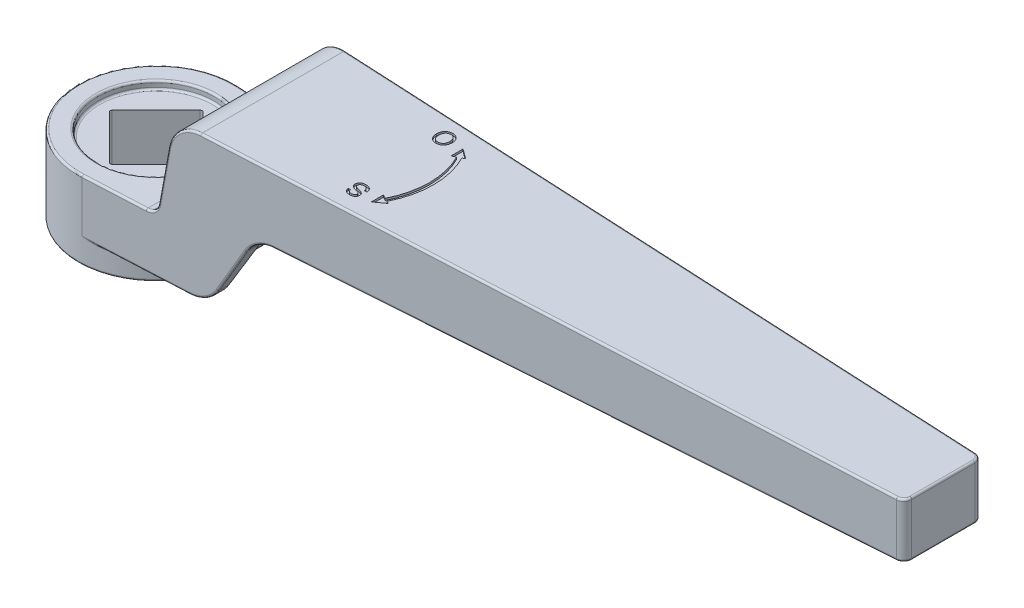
SolidWorks part; units mm, degrees
ref_plane "前基準面" through (0, 0, 0) normal (0, 0, 1) x (1, 0, 0)
ref_plane "上基準面" through (0, 0, 0) normal (0, 1, 0) x (1, 0, 0)
ref_plane "右基準面" through (0, 0, 0) normal (1, 0, 0) x (0, 0, -1)
sketch "草圖1" plane through (0, 0, 0) normal (0, 0, 1) x (1, 0, 0)
  line L1 (-42, 14) -> (-42, -6)
  line L2 (-42, -6) -> (0, -6)
  line L3 (0, 0) -> (0, -6)
  line L4 (-42, 14) -> (-3.2856, 14)
  line L5 (-0.3312, 16.4791) -> (2.1215, 30.3892)
  line L6 (0, 0) -> (7.25, 0)
  line L7 (10, 37) -> (182, 37)
  line L8 (14.1782, 4) -> (21.1073, 16.0015)
  line L9 (27.8798, 20) -> (182, 23)
  line L10 (182, 37) -> (182, 23)
  arc A11 (-3.2856, 14) -> (-0.3312, 16.4791) centre (-3.2856, 17) ccw
  arc A12 (7.25, 0) -> (14.1782, 4) centre (7.25, 8) ccw
  arc A13 (27.8798, 20) -> (21.1073, 16.0015) centre (28.0355, 12.0015) ccw
  arc A14 (10, 37) -> (2.1215, 30.3892) centre (10, 29) ccw
  dimension "D4" = 3
  dimension "D5" = 14
  dimension "D6" = 8
  dimension "D7" = 17
  dimension "D1" = 20
  dimension "D2" = 42
  dimension "D3" = 10
  dimension "D8" = 182
  dimension "D9" = 43
  dimension "D10" = 30
  dimension "D11" = 6
  dimension "D12" = 7.25
  dimension "D13" = 10
extrude "伸長1" add sketch "草圖1" along normal mid plane 45
sketch "草圖2" plane through (0, 37, 0) normal (0, 1, 0) x (-1, 0, 0)
  line L0 (19.0087, -19.9754) -> (-182, -10)
  line L1 (-182, -10) -> (-182, 10)
  line L2 (-182, 10) -> (19.0087, 19.9754)
  line L3 (45.8046, 0) -> (-190.5175, 0) construction
  line L8 (-182, 22.5) -> (-182, -22.5) construction
  line L99 (-10, -23.5) -> (-2.1215, -23.5)
  line L100 (-2.1215, -23.5) -> (0.3312, -23.5)
  line L101 (0.3312, -23.5) -> (3.2856, -23.5)
  line L102 (3.2856, -23.5) -> (43, -23.5)
  line L103 (43, -23.5) -> (43, 23.5)
  line L104 (3.2856, 23.5) -> (0.3312, 23.5)
  line L105 (0.3312, 23.5) -> (-2.1215, 23.5)
  line L106 (43, 23.5) -> (3.2856, 23.5)
  line L107 (-2.1215, 23.5) -> (-10, 23.5)
  line L108 (-10, 23.5) -> (-183, 23.5)
  line L109 (-183, 23.5) -> (-183, -23.5)
  line L110 (-183, -23.5) -> (-10, -23.5)
  line L111 (-10, -23.5) -> (-2.1215, -23.5)
  line L112 (-2.1215, -23.5) -> (0.3312, -23.5)
  line L113 (0.3312, -23.5) -> (3.2856, -23.5)
  line L114 (3.2856, -23.5) -> (43, -23.5)
  line L115 (43, -23.5) -> (43, 23.5)
  line L116 (3.2856, 23.5) -> (0.3312, 23.5)
  line L117 (0.3312, 23.5) -> (-2.1215, 23.5)
  line L118 (43, 23.5) -> (3.2856, 23.5)
  line L119 (-2.1215, 23.5) -> (-10, 23.5)
  line L120 (-10, 23.5) -> (-183, 23.5)
  line L121 (-183, 23.5) -> (-183, -23.5)
  line L122 (-183, -23.5) -> (-10, -23.5)
  arc A0 (19.0087, -19.9754) -> (19.0087, 19.9754) centre (20, 0) ccw
  dimension "D2" = 20
  dimension "D1" = 20
  dimension "D3" = 20
  dimension "D4" = 1
extrude "除料-伸長1" cut sketch "草圖2" against normal through all
sketch "草圖3" plane through (0, -6, 0) normal (0, -1, 0) x (1, 0, 0)
  line L0 (-19.0087, 19.9754) -> (3.625, 18.8522)
  line L1 (0, 19.0321) -> (7.25, 18.6723) construction
  line L2 (3.625, 18.8522) -> (3.625, -18.8522)
  line L3 (7.25, -18.6723) -> (0, -19.0321) construction
  line L4 (3.625, -18.8522) -> (-19.0087, -19.9754)
  line L5 (-3.2856, 19.1951) -> (-19.0087, 19.9754) construction
  arc A0 (-19.0087, 19.9754) -> (-19.0087, -19.9754) centre (-20, 0) cw
  arc A1 (-19.0087, 19.9754) -> (-19.0087, -19.9754) centre (-20, 0) ccw construction
extrude "除料-伸長2" cut sketch "草圖3" against normal up to surface (6 mm away)
fillet "圓角1" radius 2 2 edges at (182, 30, 10) (182, 30, -10)
sketch "草圖4" plane through (0, 0, 0) normal (0, -1, 0) x (1, 0, 0)
  line L101 (7.1013, -15.676) -> (-19.1574, -16.9791)
  line L102 (14.0295, -15.3321) -> (7.1013, -15.676)
  line L103 (20.9586, -14.9883) -> (14.0295, -15.3321)
  line L104 (27.7311, -14.6522) -> (20.9586, -14.9883)
  line L105 (-19.1574, 16.9791) -> (7.1013, 15.676)
  line L106 (7.1013, 15.676) -> (14.0295, 15.3321)
  line L107 (14.0295, 15.3321) -> (20.9586, 14.9883)
  line L108 (20.9586, 14.9883) -> (27.7311, 14.6522)
  line L109 (179, 7.1452) -> (179, -7.1452)
  line L110 (179, -7.1452) -> (27.7311, -14.6522)
  line L111 (27.7311, 14.6522) -> (179, 7.1452)
  line L114 (20.9586, -14.9883) -> (0.4908, -16.004)
  line L115 (27.7311, -14.6522) -> (20.9586, -14.9883)
  line L118 (0.4908, 16.004) -> (20.9586, 14.9883)
  line L119 (20.9586, 14.9883) -> (27.7311, 14.6522)
  line L120 (179, 7.1452) -> (179, -7.1452)
  line L121 (179, -7.1452) -> (27.7311, -14.6522)
  line L122 (27.7311, 14.6522) -> (179, 7.1452)
  circle A3 centre (-20, 0) radius 26
  arc A4 (0.4908, -16.004) -> (0.4908, 16.004) centre (-20, 0) ccw
  dimension "D2" = 6
  dimension "D1" = 3
extrude "除料-伸長3" cut sketch "草圖4" against normal blind 32 draft 3
chamfer "導角1" distance 32 distance2 3 1 edges at (7.677, 32, 0)
fillet "圓角12" radius 2 4 edges at (177.5609, 27.4591, 5.7758) (177.5609, 27.4591, -5.7758)
sketch "草圖6" plane through (0, 14, 0) normal (0, 1, 0) x (-1, 0, 0)
  circle A0 centre (20, 0) radius 15
  dimension "D1" = 30
extrude "除料-伸長5" cut sketch "草圖6" against normal blind 2
sketch "草圖7" plane through (0, -6, 0) normal (0, -1, 0) x (1, 0, 0)
  circle A0 centre (-20, 0) radius 15
  circle A1 centre (-20, 0) radius 15 construction
extrude "除料-伸長6" cut sketch "草圖7" against normal blind 2
sketch "草圖8" plane through (0, 12, 0) normal (0, 1, 0) x (-1, 0, 0)
  line L0 (0, 0) -> (43.1421, 0) construction
  line L1 (20, 22.8587) -> (20, -24.7848) construction
  line L2 (20, 12.0208) -> (7.9792, 0)
  line L3 (20, 12.0208) -> (32.0208, 0)
  line L4 (7.9792, 0) -> (20, -12.0208)
  line L5 (32.0208, 0) -> (20, -12.0208)
  dimension "D1" = 17
extrude "除料-伸長7" cut sketch "草圖8" against normal through all
fillet "圓角3" radius 0.5 29 edges at (-11.1472, 14, -19.5853) (-1.3573, 14.7019, -19.0994) (0.8952, 23.4341, -18.9877) (4.8577, 35.1284, -18.791) (95.0496, 37, -14.3151) (181.4488, 37, -9.4755) (182, 37, 0) (181.4488, 37, 9.4755) (-5.8793, 0, -19.3239) (11.25, 1.0718, -18.4738) (17.6427, 10.0008, -18.1565) (23.9683, 18.8905, -17.8426) (103.9895, 21.4815, -13.8714) (181.4488, 22.9893, -9.4755) (182, 23, 0) (181.4488, 22.9893, 9.4755) (-20, -6, 20) (-40, 14, 0) (0, 0, 0) (23.9683, 18.8905, 17.8426) (17.6427, 10.0008, 18.1565) (11.25, 1.0718, 18.4738) (-5.8793, 0, 19.3239) (-11.1472, 14, 19.5853) (-1.3573, 14.7019, 19.0994) (0.8952, 23.4341, 18.9877) (4.8577, 35.1284, 18.791) (95.0496, 37, 14.3151) (103.9895, 21.4815, 13.8714)
fillet "圓角6" radius 0.5 8 edges at (-20, -6, -15) (-20, -4, -15) (-35, 14, 0) (-35, 12, 0) (-32.0208, 4, 0) (-20, 4, 12.0208) (-7.9792, 4, 0) (-20, 4, -12.0208)
fillet "圓角10" radius 0.5 29 edges at (101.8912, 21.4407, 9.8468) (11.25, 1.0718, 15.4138) (17.6427, 10.0008, 14.6281) (23.9683, 18.8905, 13.8477) (17.6427, 10.0008, -14.6281) (11.25, 1.0718, -15.4138) (23.9683, 18.8905, -13.8477) (5.8536, 0, 15.7379) (177.323, 32, 0) (177.7989, 22.9182, 0) (92.9953, 32, -9.7342) (5.8536, 0, -15.7379) (101.8912, 21.4407, -9.8468) (7.4631, 15.2731, -14.8566) (92.9953, 32, 9.7342) (10.677, 32, 0) (8.7961, 32, 12.9555) (8.8462, 32, -13.0255) (176.7728, 32, 5.0258) (176.7728, 32, -5.0258) (7.4631, 15.2731, 14.8566) (2.5684, 0.0268, 12.9127) (2.5807, 0.0353, -12.8922) (5.5732, 15.4579, 12.02) (3.1075, 2.5718, -12.7094) (177.2493, 22.9075, -5.4793) (177.2493, 22.9075, 5.4793) (2.6773, 0, -14.9324) (2.6379, 0, 14.872)
fillet "圓角11" radius 0.5 1 edges at (6, 0, 0)
sketch "草圖9" plane through (0, 37, 0) normal (0, 1, 0) x (-1, 0, 0)
  line L0 (0, 0) -> (-144.6999, 0) construction
  line L1 (-47, -11.7587) -> (-47, -8.6703)
  line L2 (-47, -8.6703) -> (-47.9684, -9.1642)
  line L3 (-49.5, -9.9454) -> (-47, -11.7587)
  line L4 (-47, 11.7587) -> (-47, 8.6703)
  line L5 (-47, 8.6703) -> (-47.9684, 9.1642)
  line L6 (-49.5, 9.9454) -> (-47, 11.7587)
  line L7 (-47, -22.961) -> (-47, 22.4352) construction
  line L8 (-48.8593, -9.6186) -> (-49.5, -9.9454)
  line L9 (-48.8593, 9.6186) -> (-49.5, 9.9454)
  circle A0 centre (-30, 0) radius 20.6705 construction
  arc A1 (-48.8593, 9.6186) -> (-48.8593, -9.6186) centre (-30, 0) ccw
  arc A2 (-47.9684, 9.1642) -> (-47.9684, -9.1642) centre (-30, 0) ccw
  circle A3 centre (-30, 0) radius 21.1705 construction
  circle A4 centre (-30, 0) radius 20.1705 construction
  dimension "D2" = 41.3409
  dimension "D1" = 30
  dimension "D5" = 17
  dimension "D6" = 2.5
  dimension "D3" = 0.5
  dimension "D4" = 1
extrude "除料-伸長9" cut sketch "草圖9" against normal blind 0.5
sketch "草圖14" plane through (0, 37, 0) normal (0, 1, 0) x (-1, 0, 0)
  line L0 (-44.5002, -20.497) -> (-44.5002, 22.0722) construction
  text T0 "S      O" font "Arial" height in points 12
extrude "除料-伸長8" cut sketch "草圖14" against normal blind 0.5
